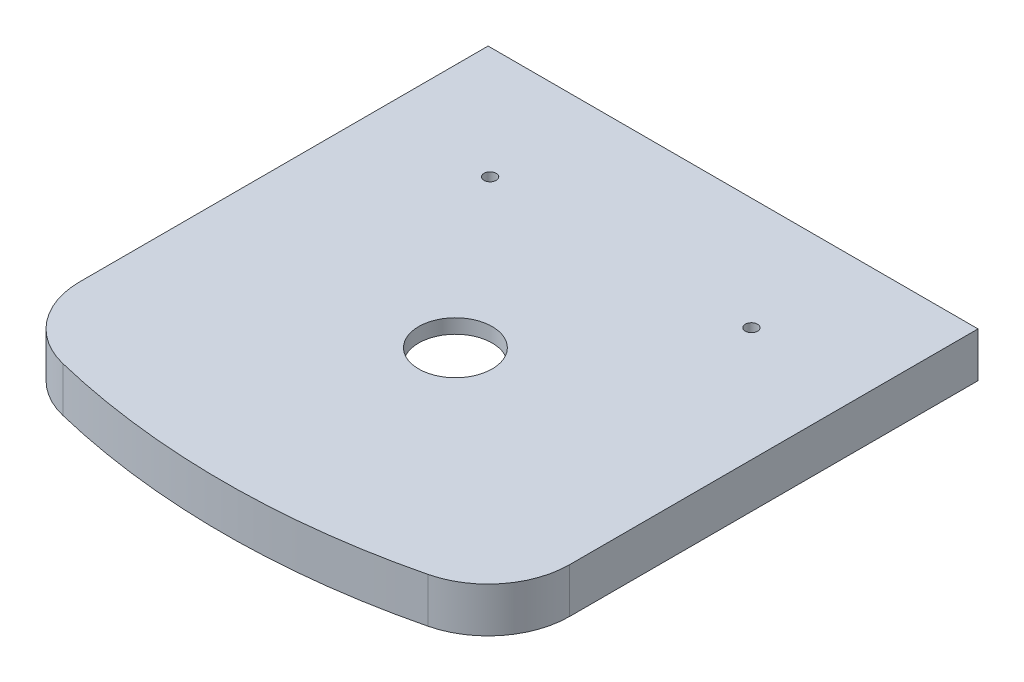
SolidWorks part; units mm, degrees
ref_plane "Plan de face" through (0, 0, 0) normal (0, 0, 1) x (1, 0, 0)
ref_plane "Plan de dessus" through (0, 0, 0) normal (0, 1, 0) x (1, 0, 0)
ref_plane "Plan de droite" through (0, 0, 0) normal (1, 0, 0) x (0, 0, -1)
sketch "Esquisse1" plane through (0, 0, 0) normal (0, 1, 0) x (1, 0, 0)
  line L0 (-18.0127, -5) -> (126.8682, -5) construction
  line L2 (0, 20) -> (0, 120)
  line L3 (0, 120) -> (120, 120)
  line L4 (120, 20) -> (120, 120)
  arc A0 (15.2482, 0.5727) -> (0, 20) centre (20, 20) cw
  arc A1 (104.7518, 0.5727) -> (120, 20) centre (100, 20) ccw
  arc A2 (15.2482, 0.5727) -> (104.7518, 0.5727) centre (60, 183.5366) ccw
  dimension "D2" = 20
  dimension "D3" = 125
  dimension "D1" = 120
  dimension "D4" = 100
  dimension "D5" = 100
extrude "Extrusion1" add sketch "Esquisse1" along normal blind 11
shell "Coque1" thickness 3.5
sketch "Esquisse3" plane through (0, 7.5, 0) normal (0, -1, 0) x (1, 0, 0)
  line L0 (60, -116.5) -> (60, 1.3208) construction
  line L1 (116.5, -116.5) -> (3.5, -116.5) construction
  line L2 (120, -120) -> (0, -120) construction
  arc A0 (103.9202, -3.9725) -> (16.0798, -3.9725) centre (60, -183.5366) ccw construction
  circle A1 centre (87.5, -99) radius 5
  circle A2 centre (87.5, -69) radius 5
  circle A3 centre (87.5, -69) radius 1.5
  circle A4 centre (87.5, -99) radius 1.5
  circle A5 centre (32.5, -99) radius 1.5
  circle A6 centre (32.5, -69) radius 1.5
  circle A7 centre (32.5, -69) radius 5
  circle A8 centre (32.5, -99) radius 5
  dimension "D1" = 21
  dimension "D3" = 30
  dimension "D2" = 27.5
extrude "Extrusion2" add sketch "Esquisse3" along normal blind 9.5
sketch "Esquisse4" plane through (0, 7.5, 0) normal (0, -1, 0) x (1, 0, 0)
  line L0 (60, -116.5) -> (60, 1.3208) construction
  line L1 (116.5, -116.5) -> (3.5, -116.5) construction
  line L2 (120, -120) -> (0, -120) construction
  line L3 (120, -20) -> (120, -120) construction
  arc A0 (103.9202, -3.9725) -> (16.0798, -3.9725) centre (60, -183.5366) ccw construction
  circle A1 centre (92, -92.5) radius 1.5
  circle A2 centre (28, -92.5) radius 1.5
  dimension "D1" = 27.5
  dimension "D2" = 28
extrude "Enlèv. mat.-Extru.1" cut sketch "Esquisse4" against normal through all
sketch "Esquisse5" plane through (0, 11, 0) normal (0, 1, 0) x (-1, 0, 0)
  circle A0 centre (-60, -52) radius 9
extrude "Enlèv. mat.-Extru.2" cut sketch "Esquisse5" against normal through all
sketch "Esquisse6" plane through (0, 7.5, 0) normal (0, -1, 0) x (1, 0, 0)
  line L0 (116.5, -50.2) -> (116.5, -53.8)
  line L1 (3.5, -50.2) -> (3.5, -53.8)
  line L2 (3.5, -113.7682) -> (3.5, -116.5)
  line L3 (3.5, -116.5) -> (3.5, -20) construction
  line L4 (3.5, -116.5) -> (5.8929, -116.5)
  line L5 (116.5, -116.5) -> (3.5, -116.5) construction
  line L6 (61.8, -116.5) -> (58.2, -116.5)
  line L7 (111.1968, -7.8277) -> (75.7153, -37.2702)
  line L8 (81.5, -53.8) -> (116.5, -53.8)
  line L9 (116.5, -113.7682) -> (116.5, -116.5)
  line L10 (116.5, -113.7682) -> (75.5207, -66.9866)
  line L11 (58.2, -73.5) -> (58.2, -116.5)
  line L12 (7.0205, -9.8126) -> (3.5, -116.5) construction
  line L13 (5.8929, -116.5) -> (47.1873, -69.3587)
  line L14 (116.5, -20) -> (116.5, -116.5) construction
  line L15 (116.5, -116.5) -> (114.1071, -116.5)
  line L16 (38.5, -50.2) -> (3.5, -50.2)
  line L17 (44.3023, -37.199) -> (8.1418, -8.4045)
  line L18 (61.8, -30.5) -> (61.8, 1.3208)
  line L19 (113.8803, -10.9286) -> (78.3013, -40.3865)
  line L23 (3.5, -113.7682) -> (44.4793, -66.9866)
  line L24 (61.8, -73.5) -> (61.8, -116.5)
  line L25 (114.1071, -116.5) -> (72.8127, -69.3587)
  line L26 (81.5, -50.2) -> (116.5, -50.2)
  line L27 (38.5, -53.8) -> (3.5, -53.8)
  line L28 (58.2, -30.5) -> (58.2, 1.3208)
  line L29 (42.0597, -40.0152) -> (5.8993, -11.2207)
  circle A0 centre (60, -52) radius 19
  arc A1 (72.8127, -69.3587) -> (61.8, -73.5) centre (60.1978, -52.5259) cw
  arc A2 (111.1968, -7.8277) -> (113.8803, -10.9286) centre (101.5411, -18.895) cw
  arc A3 (58.2, -30.5) -> (44.3023, -37.199) centre (59.8011, -51.5873) ccw
  arc A4 (16.0798, -3.9725) -> (3.5, -20) centre (20, -20) ccw construction
  arc A5 (47.1873, -69.3587) -> (58.2, -73.5) centre (60.7682, -49.9572) ccw
  arc A6 (75.7153, -37.2702) -> (61.8, -30.5) centre (60.1051, -51.6696) ccw
  arc A7 (75.5207, -66.9866) -> (81.5, -53.8) centre (58.9309, -51.5152) ccw
  arc A8 (81.5, -50.2) -> (78.3013, -40.3865) centre (59.1555, -52.055) ccw
  arc A9 (42.0597, -40.0152) -> (38.5, -50.2) centre (60.7641, -52.2671) ccw
  arc A10 (38.5, -53.8) -> (44.4793, -66.9866) centre (58.8894, -52.5036) ccw
  arc A11 (58.2, 1.3208) -> (61.8, 1.3208) centre (60, 38.2854) ccw
  arc A12 (8.1418, -8.4045) -> (5.8993, -11.2207) centre (14.5213, -15.7855) ccw
extrude "Extrusion5" add sketch "Esquisse6" along normal blind 7
sketch "Esquisse7" plane through (0, 0.5, 0) normal (0, -1, 0) x (1, 0, 0)
  circle A0 centre (60, -80) radius 1.5
  circle A1 centre (38.0961, -34.5581) radius 1.5
  circle A2 centre (81.9039, -34.5581) radius 1.5
extrude "Enlèv. mat.-Extru.3" cut sketch "Esquisse7" against normal blind 5
